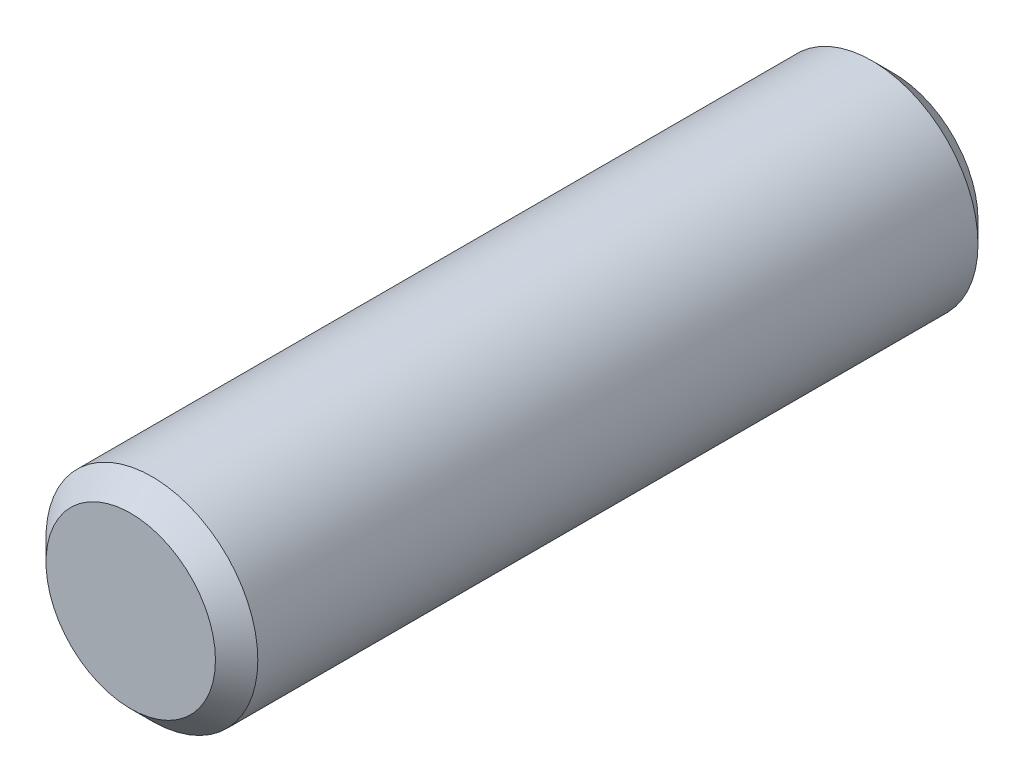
SolidWorks part; units mm, degrees
ref_plane "Plan1" through (0, 0, 0) normal (0, 0, 1) x (1, 0, 0)
ref_plane "Plan2" through (0, 0, 0) normal (0, 1, 0) x (1, 0, 0)
ref_plane "Plan3" through (0, 0, 0) normal (1, 0, 0) x (0, 0, -1)
sketch "Esquisse1" plane through (0, 0, 0) normal (0, 0, 1) x (1, 0, 0)
  circle A0 centre (0, 0) radius 2.5
  dimension "D1" = 5
extrude "Base-Extrusion" add sketch "Esquisse1" along normal blind 18
chamfer "Chanfrein1" distance 0.5 angle 45
